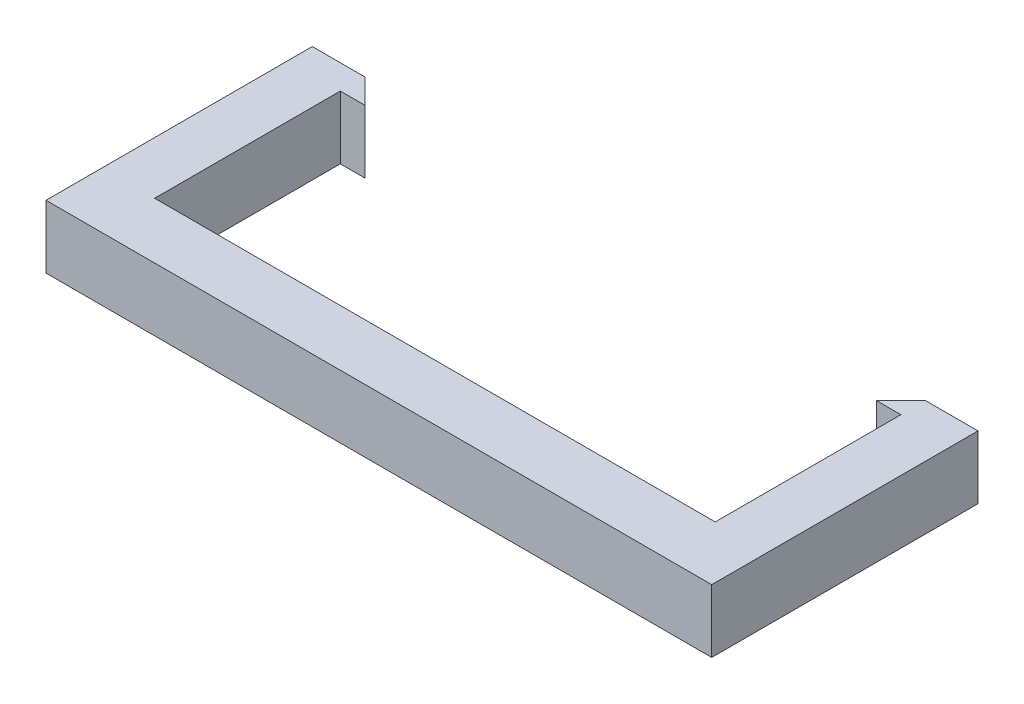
SolidWorks part; units mm, degrees
ref_plane "Plan de face" through (0, 0, 0) normal (0, 0, 1) x (1, 0, 0)
ref_plane "Plan de dessus" through (0, 0, 0) normal (0, 1, 0) x (1, 0, 0)
ref_plane "Plan de droite" through (0, 0, 0) normal (1, 0, 0) x (0, 0, -1)
sketch "Esquisse1" plane through (0, 0, 0) normal (0, 0, 1) x (1, 0, 0)
  line L1 (-49.7209, 12.238) -> (45.2791, 12.238)
  line L2 (-49.7209, 12.238) -> (-49.7209, 3.238)
  line L3 (-49.7209, 3.238) -> (45.2791, 3.238)
  line L4 (45.2791, 12.238) -> (45.2791, 3.238)
  dimension "D1" = 95
  dimension "D2" = 9
extrude "Boss.-Extru.1" add sketch "Esquisse1" along normal blind 8
sketch "Esquisse2" plane through (0, 0, 0) normal (0, 0, -1) x (-1, 0, 0)
  line L0 (-45.2791, 12.238) -> (49.7209, 12.238) construction
  line L1 (49.7209, 3.238) -> (42.2209, 3.238)
  line L2 (49.7209, 3.238) -> (49.7209, 12.238)
  line L3 (49.7209, 12.238) -> (42.2209, 12.238)
  line L4 (42.2209, 3.238) -> (42.2209, 12.238)
  line L6 (-45.2791, 3.238) -> (-37.7791, 3.238)
  line L7 (-45.2791, 3.238) -> (-45.2791, 12.238)
  line L8 (-45.2791, 12.238) -> (-37.7791, 12.238)
  line L9 (-37.7791, 3.238) -> (-37.7791, 12.238)
  dimension "D1" = 80
  dimension "D2" = 7.5
  dimension "D3" = 7.5
extrude "Boss.-Extru.2" add sketch "Esquisse2" along normal blind 30
sketch "Esquisse3" plane through (-42.2209, 0, 0) normal (1, 0, 0) x (0, 0, -1)
  line L0 (30, 12.238) -> (0, 12.238) construction
  line L1 (30, 3.238) -> (26.5, 3.238)
  line L2 (30, 3.238) -> (30, 12.238)
  line L3 (30, 12.238) -> (26.5, 12.238)
  line L4 (26.5, 3.238) -> (26.5, 12.238)
  line L5 (0, 12.238) -> (0, 3.238) construction
  point P7 (0, 7.738)
  dimension "D1" = 26.5
extrude "Boss.-Extru.4" add sketch "Esquisse3" along normal blind 5
sketch "Esquisse4" plane through (37.7791, 0, 0) normal (-1, 0, 0) x (0, 0, 1)
  line L0 (-30, 12.238) -> (0, 12.238) construction
  line L1 (-30, 3.238) -> (-26.5, 3.238)
  line L2 (-30, 3.238) -> (-30, 12.238)
  line L3 (-30, 12.238) -> (-26.5, 12.238)
  line L4 (-26.5, 3.238) -> (-26.5, 12.238)
  line L5 (0, 3.238) -> (0, 12.238) construction
  dimension "D1" = 26.5
extrude "Boss.-Extru.5" add sketch "Esquisse4" along normal blind 5
chamfer "Chanfrein1" distance 5 angle 45 1 edges at (-37.2209, 7.738, -30)
chamfer "Chanfrein2" distance 5 angle 45 1 edges at (32.7791, 7.738, -30)
